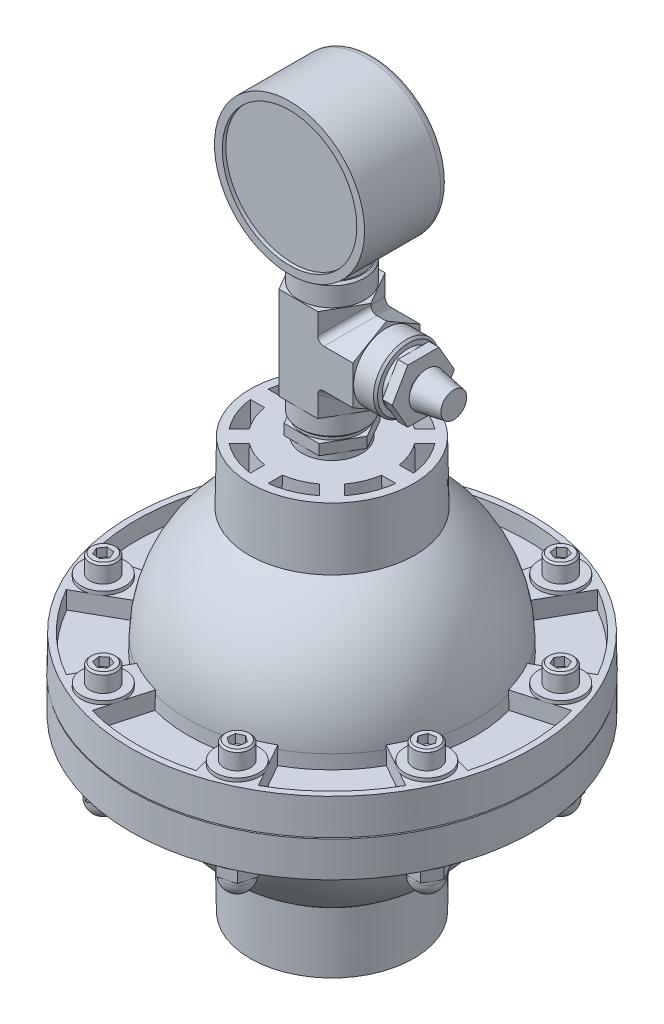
SolidWorks part; units mm, degrees
ref_plane "Front Plane" through (0, 0, 0) normal (0, 0, 1) x (1, 0, 0)
ref_plane "Top Plane" through (0, 0, 0) normal (0, 1, 0) x (1, 0, 0)
ref_plane "Right Plane" through (0, 0, 0) normal (1, 0, 0) x (0, 0, -1)
sketch "Sketch1" plane through (0, 0, 0) normal (0, 1, 0) x (1, 0, 0)
  circle A0 centre (0, 0) radius 72.39
  circle A1 centre (0, 0) radius 69.723
  dimension "D1" = 144.78
  dimension "D2" = 2.667
extrude "Boss-Extrude1" add sketch "Sketch1" along normal blind 12.7 draft 1
ref_plane "Plane1" through (0, -0.508, 0) normal (0, 1, 0) x (1, 0, 0)
sketch "Sketch5" plane through (0, 0, 0) normal (0, 1, 0) x (1, 0, 0)
  circle A0 centre (0, 0) radius 72.2624
extrude "Boss-Extrude5" add sketch "Sketch5" along normal blind 6.35
sketch "Sketch6" plane through (0, -0.508, 0) normal (0, 1, 0) x (1, 0, 0)
  circle A0 centre (0, 0) radius 59.4995
  dimension "D1" = 118.999
extrude "Boss-Extrude6" add sketch "Sketch6" along normal blind 6.35
sketch "Sketch7" plane through (0, -0.508, 0) normal (0, 1, 0) x (1, 0, 0)
  circle A0 centre (0, 0) radius 72.263
  circle A1 centre (0, 0) radius 69.596
  dimension "D1" = 2.667
extrude "Boss-Extrude7" add sketch "Sketch7" against normal blind 12.7 separate body
sketch "Sketch8" plane through (0, -0.508, 0) normal (0, 1, 0) x (1, 0, 0)
  circle A0 centre (0, 0) radius 72.263
extrude "Boss-Extrude8" add sketch "Sketch8" against normal blind 6.35 draft 1
sketch "Sketch9" plane through (0, 0, 0) normal (0, 1, 0) x (1, 0, 0)
  circle A0 centre (0, 0) radius 51.689
  dimension "D1" = 103.378
extrude "Boss-Extrude9" add sketch "Sketch9" along normal blind 59.944 draft 1
sketch "Sketch10" plane through (0, -0.508, 0) normal (0, 1, 0) x (1, 0, 0)
  circle A0 centre (0, 0) radius 51.689
extrude "Boss-Extrude10" add sketch "Sketch10" against normal blind 59.944 draft 1
ref_plane "Plane2" through (0, 73.533, 0) normal (0, 1, 0) x (1, 0, 0)
ref_plane "Plane3" through (0, -74.041, 0) normal (0, 1, 0) x (1, 0, 0)
fillet "Fillet1" radius 49.53 2 edges at (0, 59.944, 50.6427) (0, -60.452, 50.6427)
sketch "Sketch12" plane through (0, 73.533, 0) normal (0, 1, 0) x (1, 0, 0)
  circle A0 centre (0, 0) radius 29.337
  dimension "D1" = 58.674
extrude "Boss-Extrude11" add sketch "Sketch12" against normal up to surface (86.741 mm away) draft 1
sketch "Sketch13" plane through (0, -74.041, 0) normal (0, 1, 0) x (1, 0, 0)
  circle A0 centre (0, 0) radius 29.337
  dimension "D1" = 58.674
extrude "Boss-Extrude12" add sketch "Sketch13" along normal up to surface (86.741 mm away) draft 1
sketch "Sketch15" plane through (0, 73.533, 0) normal (0, 1, 0) x (1, 0, 0)
  circle A0 centre (0, 0) radius 26.289
  circle A1 centre (0, 0) radius 21.209
  dimension "D1" = 52.578
  dimension "D2" = 5.08
extrude "Cut-Extrude1" cut sketch "Sketch15" against normal blind 16.129 draft 1
sketch "Sketch16" plane through (0, -74.041, 0) normal (0, 1, 0) x (1, 0, 0)
  circle A0 centre (0, 0) radius 26.289
  circle A1 centre (0, 0) radius 21.209
  dimension "D1" = 52.578
  dimension "D2" = 5.08
extrude "Cut-Extrude2" cut sketch "Sketch16" along normal blind 16.129 draft 1
hole_wizard "1 NPT Tapped Hole2" positions "Sketch20" profile "Sketch19" size "1" standard "ANSI Inch"
sketch "Sketch20" plane through (0, -74.041, 0) normal (0, 1, 0) x (1, 0, 0)
  point P0 (0, 0)
sketch "Sketch19" plane through (0, -74.041, 0) normal (1, 0, 0) x (0, 0, -1)
  line L0 (0, 0) -> (0, 36.6469)
  line L1 (14.4907, 27.94) -> (0, 36.6469)
  line L2 (-14.4907, 27.94) -> (0, 36.6469) construction
  line L3 (14.4907, 27.94) -> (14.4907, 16.764)
  line L4 (14.4907, 16.764) -> (15.228, 16.764)
  line L5 (15.228, 16.764) -> (15.7299, 0)
  line L6 (-15.228, 16.764) -> (-15.7299, 0) construction
  line L7 (15.7299, 0) -> (0, 0)
  line L8 (0, -6.35) -> (0, 107.95) construction
  line L11 (-14.4907, 16.764) -> (-15.228, 16.764) construction
  dimension "Tap Drill Dia." = 28.9814
  dimension "Tap Drill Depth" = 27.94
  dimension "Thread Dia." = 31.4598
  dimension "Thread Angle" = 3.43
  dimension "Thread Depth" = 16.764
  dimension "Drill Angle" = 118
sketch "Sketch21" plane through (0, 73.533, 0) normal (0, 1, 0) x (1, 0, 0)
  line L0 (0, 0) -> (-33.734, 0) construction
  line L1 (-18.7204, 3.175) -> (-27.9661, 3.175)
  line L2 (-27.9661, 3.175) -> (-27.9661, -3.175)
  line L3 (-27.9661, -3.175) -> (-18.7204, -3.175)
  line L4 (-18.7204, -3.175) -> (-18.7204, 3.175)
  dimension "D1" = 3.175
  dimension "D2" = 6.35
extrude "Boss-Extrude13" add sketch "Sketch21" against normal up to surface (16.129 mm away)
pattern_circular "CirPattern1" count 8 over 360 about axis through (0, 0, 0) along (0, 1, 0) of "Boss-Extrude13"
sketch "Sketch22" plane through (0, -74.041, 0) normal (0, 1, 0) x (1, 0, 0)
  line L0 (0, 0) -> (-35.816, 0) construction
  line L1 (-18.9475, -3.175) -> (-28.1821, -3.175)
  line L2 (-28.1821, -3.175) -> (-28.1821, 3.175)
  line L3 (-28.1821, 3.175) -> (-18.9475, 3.175)
  line L4 (-18.9475, 3.175) -> (-18.9475, -3.175)
  dimension "D1" = 3.175
  dimension "D2" = 6.35
extrude "Boss-Extrude14" add sketch "Sketch22" along normal up to surface (16.129 mm away)
pattern_circular "CirPattern2" count 8 over 360 about axis through (0, 0, 0) along (0, 1, 0) of "Boss-Extrude14"
ref_plane "Plane4" through (0, 12.7, 0) normal (0, 1, 0) x (1, 0, 0)
ref_plane "Plane5" through (0, -13.208, 0) normal (0, 1, 0) x (1, 0, 0)
sketch "Sketch23" plane through (0, 12.7, 0) normal (0, 1, 0) x (1, 0, 0)
  line L0 (-44.703, 12.3972) -> (-69.031, 19.144)
  line L1 (0, 0) -> (-76.445, 0) construction
  line L2 (0, 0) -> (-68.8957, 38.9793) construction
  line L3 (0, 0) -> (-75.2794, 20.8768) construction
  line L4 (-69.031, 19.144) -> (-62.3496, 35.2757)
  line L5 (-62.3496, 35.2757) -> (-41.612, 23.543)
  line L6 (-41.612, 23.543) -> (-44.703, 12.3972)
  dimension "D1" = 29.5
  dimension "D2" = 15.5
extrude "Boss-Extrude15" add sketch "Sketch23" against normal up to surface (6.35 mm away)
pattern_circular "CirPattern3" count 8 over 360 about axis through (0, 0, 0) along (0, 1, 0) of "Boss-Extrude15"
sketch "Sketch24" plane through (0, -13.208, 0) normal (0, 1, 0) x (1, 0, 0)
  line L0 (0, 0) -> (-77.758, 0) construction
  line L1 (0, 0) -> (-75.1927, -20.8528) construction
  line L2 (0, 0) -> (-67.4621, -38.1682) construction
  line L3 (-45.2436, -12.5472) -> (-69.0113, -19.1385)
  line L4 (-69.0113, -19.1385) -> (-62.0998, -35.1344)
  line L5 (-62.0998, -35.1344) -> (-42.1153, -23.8277)
  line L6 (-42.1153, -23.8277) -> (-45.2436, -12.5472)
  dimension "D1" = 15.5
  dimension "D2" = 29.5
extrude "Boss-Extrude16" add sketch "Sketch24" along normal up to surface (6.35 mm away)
pattern_circular "CirPattern4" count 8 over 360 about axis through (0, 0, 0) along (0, 1, 0) of "Boss-Extrude16"
sketch "Sketch25" plane through (0, 12.7, 0) normal (0, 1, 0) x (1, 0, 0)
  line L0 (0, 0) -> (-76.7572, 0) construction
  line L1 (0, 0) -> (-73.8259, 30.5797) construction
  circle A0 centre (0, 0) radius 62.8015 construction
  circle A2 centre (-58.021, 24.0331) radius 7.874
  dimension "D1" = 125.603
  dimension "D3" = 15.748
  dimension "D2" = 22.5
extrude "Boss-Extrude17" add sketch "Sketch25" along normal blind 1.27
pattern_circular "CirPattern5" count 8 over 360 about axis through (0, 0, 0) along (0, 1, 0) of "Boss-Extrude17"
sketch "Sketch26" plane through (0, -13.208, 0) normal (0, 1, 0) x (1, 0, 0)
  line L0 (0, 0) -> (-77.404, 0) construction
  line L1 (0, 0) -> (-73.5901, -30.482) construction
  circle A0 centre (0, 0) radius 62.8015 construction
  circle A5 centre (-58.021, -24.0331) radius 7.874
  dimension "D1" = 125.603
  dimension "D3" = 15.748
  dimension "D2" = 22.5
extrude "Boss-Extrude18" add sketch "Sketch26" against normal blind 1.27
pattern_circular "CirPattern6" count 8 over 360 about axis through (0, 0, 0) along (0, 1, 0) of "Boss-Extrude18"
sketch "Sketch27" plane through (0, 12.7, 0) normal (0, 1, 0) x (1, 0, 0)
  circle A0 centre (-58.021, 24.0331) radius 4.7625
  dimension "D1" = 9.525
extrude "Boss-Extrude19" add sketch "Sketch27" along normal blind 7.62
ref_plane "Plane6" through (0, 20.32, 0) normal (0, 1, 0) x (1, 0, 0)
sketch "Sketch28" plane through (0, 20.32, 0) normal (0, 1, 0) x (1, 0, 0)
  line L1 (-60.7279, 23.5936) -> (-58.9938, 21.4691)
  line L2 (-58.9938, 21.4691) -> (-56.287, 21.9086)
  line L3 (-56.287, 21.9086) -> (-55.3142, 24.4726)
  line L4 (-55.3142, 24.4726) -> (-57.0482, 26.597)
  line L5 (-57.0482, 26.597) -> (-59.7551, 26.1575)
  line L6 (-59.7551, 26.1575) -> (-60.7279, 23.5936)
  circle A0 centre (-58.021, 24.0331) radius 2.3749 construction
extrude "Cut-Extrude3" cut sketch "Sketch28" against normal blind 3.048
chamfer "Chamfer1" distance 0.635 angle 45 1 edges at (-58.021, 20.32, -19.2706)
pattern_circular "CirPattern7" count 8 over 360 about axis through (0, 0, 0) along (0, 1, 0) of "Boss-Extrude19", "Cut-Extrude3", "Chamfer1"
sketch "Sketch29" plane through (0, -13.208, 0) normal (0, 1, 0) x (1, 0, 0)
  line L1 (-64.1802, 24.0331) -> (-61.1006, 18.6991)
  line L2 (-61.1006, 18.6991) -> (-54.9414, 18.6991)
  line L3 (-54.9414, 18.6991) -> (-51.8618, 24.0331)
  line L4 (-51.8618, 24.0331) -> (-54.9414, 29.3671)
  line L5 (-54.9414, 29.3671) -> (-61.1006, 29.3671)
  line L6 (-61.1006, 29.3671) -> (-64.1802, 24.0331)
  circle A0 centre (-58.021, 24.0331) radius 5.334 construction
extrude "Boss-Extrude20" add sketch "Sketch29" against normal blind 6.858
sketch "Sketch30" plane through (0, -13.208, 0) normal (0, 1, 0) x (1, 0, 0)
  circle A0 centre (-58.021, 24.0331) radius 5.207
  dimension "D1" = 10.414
extrude "Boss-Extrude21" add sketch "Sketch30" against normal blind 13.208
fillet "Fillet2" radius 5.08 1 edges at (-58.021, -26.416, -18.8261)
pattern_circular "CirPattern8" count 8 over 360 about axis through (0, 0, 0) along (0, 1, 0) of "Boss-Extrude20", "Boss-Extrude21", "Fillet2"
sketch "Sketch31" plane through (0, 73.533, 0) normal (0, 1, 0) x (1, 0, 0)
  circle A0 centre (0, 0) radius 10.668
  dimension "D1" = 21.336
extrude "Boss-Extrude22" add sketch "Sketch31" along normal blind 84.836
sketch "Sketch32" plane through (0, 0, 0) normal (0, 0, 1) x (1, 0, 0)
  line L0 (10.668, 158.369) -> (-10.668, 158.369) construction
  circle A0 centre (0, 158.369) radius 26.924
extrude "Boss-Extrude23" add sketch "Sketch32" along normal mid plane 30.48
ref_plane "Plane7" through (0, 76.073, 0) normal (0, 1, 0) x (1, 0, 0)
ref_plane "Plane8" through (0, 81.153, 0) normal (0, 1, 0) x (1, 0, 0)
sketch "Sketch33" plane through (0, 76.073, 0) normal (0, 1, 0) x (1, 0, 0)
  line L1 (-12.6116, 0) -> (-6.3058, -10.922)
  line L2 (-6.3058, -10.922) -> (6.3058, -10.922)
  line L3 (6.3058, -10.922) -> (12.6116, 0)
  line L4 (12.6116, 0) -> (6.3058, 10.922)
  line L5 (6.3058, 10.922) -> (-6.3058, 10.922)
  line L6 (-6.3058, 10.922) -> (-12.6116, 0)
  circle A0 centre (0, 0) radius 10.922 construction
  dimension "D1" = 21.844
extrude "Boss-Extrude24" add sketch "Sketch33" along normal blind 3.81
sketch "Sketch34" plane through (0, 81.153, 0) normal (0, 1, 0) x (1, 0, 0)
  circle A0 centre (0, 0) radius 11.811
  dimension "D1" = 23.622
extrude "Boss-Extrude25" add sketch "Sketch34" along normal blind 48.26
ref_plane "Plane9" through (0, 88.519, 0) normal (0, 1, 0) x (1, 0, 0)
sketch "Sketch35" plane through (0, 88.519, 0) normal (0, 1, 0) x (1, 0, 0)
  line L1 (-13.9315, 0) -> (-6.9657, -12.065)
  line L2 (-6.9657, -12.065) -> (6.9657, -12.065)
  line L3 (6.9657, -12.065) -> (13.9315, 0)
  line L4 (13.9315, 0) -> (6.9657, 12.065)
  line L5 (6.9657, 12.065) -> (-6.9657, 12.065)
  line L6 (-6.9657, 12.065) -> (-13.9315, 0)
  circle A0 centre (0, 0) radius 12.065 construction
  dimension "D1" = 24.13
extrude "Boss-Extrude26" add sketch "Sketch35" along normal blind 33.274
ref_plane "Plane10" through (19.558, 0, 0) normal (1, 0, 0) x (0, 0, -1)
ref_plane "Plane11" through (27.432, 0, 0) normal (1, 0, 0) x (0, 0, -1)
sketch "Sketch36" plane through (27.432, 0, 0) normal (1, 0, 0) x (0, 0, -1)
  line L0 (0, 121.793) -> (0, 88.519) construction
  circle A0 centre (0, 105.156) radius 11.811
  dimension "D1" = 23.622
extrude "Boss-Extrude27" add sketch "Sketch36" against normal blind 25.4
sketch "Sketch37" plane through (19.558, 0, 0) normal (1, 0, 0) x (0, 0, -1)
  line L0 (0, 121.793) -> (0, 88.519) construction
  line L1 (0, 119.0875) -> (-12.065, 112.1217)
  line L2 (-12.065, 112.1217) -> (-12.065, 98.1903)
  line L3 (-12.065, 98.1903) -> (0, 91.2245)
  line L4 (0, 91.2245) -> (12.065, 98.1903)
  line L5 (12.065, 98.1903) -> (12.065, 112.1217)
  line L6 (12.065, 112.1217) -> (0, 119.0875)
  circle A0 centre (0, 105.156) radius 12.065 construction
  dimension "D1" = 24.13
extrude "Boss-Extrude28" add sketch "Sketch37" against normal blind 25.4
ref_plane "Plane12" through (32.766, 0, 0) normal (1, 0, 0) x (0, 0, -1)
sketch "Sketch38" plane through (32.766, 0, 0) normal (1, 0, 0) x (0, 0, -1)
  line L0 (0, 121.793) -> (0, 88.519) construction
  circle A0 centre (0, 105.156) radius 9.398
  dimension "D1" = 18.796
extrude "Boss-Extrude29" add sketch "Sketch38" against normal up to surface (5.334 mm away)
sketch "Sketch39" plane through (32.766, 0, 0) normal (1, 0, 0) x (0, 0, -1)
  line L0 (0, 121.793) -> (0, 88.519) construction
  line L1 (-11.1452, 105.156) -> (-5.5726, 95.504)
  line L2 (-5.5726, 95.504) -> (5.5726, 95.504)
  line L3 (5.5726, 95.504) -> (11.1452, 105.156)
  line L4 (11.1452, 105.156) -> (5.5726, 114.808)
  line L5 (5.5726, 114.808) -> (-5.5726, 114.808)
  line L6 (-5.5726, 114.808) -> (-11.1452, 105.156)
  circle A0 centre (0, 105.156) radius 9.652 construction
  dimension "D1" = 19.304
extrude "Boss-Extrude30" add sketch "Sketch39" against normal blind 3.556
ref_plane "Plane13" through (34.036, 0, 0) normal (1, 0, 0) x (0, 0, -1)
sketch "Sketch40" plane through (34.036, 0, 0) normal (1, 0, 0) x (0, 0, -1)
  line L0 (0, 121.793) -> (0, 88.519) construction
  circle A0 centre (0, 105.156) radius 4.7625
  dimension "D1" = 9.525
extrude "Boss-Extrude31" add sketch "Sketch40" against normal up to surface (1.27 mm away)
sketch "Sketch41" plane through (34.036, 0, 0) normal (1, 0, 0) x (0, 0, -1)
  line L0 (0, 121.793) -> (0, 88.519) construction
  circle A0 centre (0, 105.156) radius 6.35
  dimension "D1" = 12.7
extrude "Boss-Extrude32" add sketch "Sketch41" along normal blind 9.652 draft 10
fillet "Fillet3" radius 3.175 1 edges at (26.924, 158.369, -15.24)
chamfer "Chamfer2" distance 0.762 angle 45 3 edges at (0, 81.153, 11.811) (27.432, 105.156, -11.811) (0, 129.413, 11.811)
fillet "Fillet4" radius 2.54 4 edges at (10.4486, 94.7074, -6.0325) (10.4486, 94.7074, 6.0325) (10.4486, 115.6046, -6.0325) (10.4486, 115.6046, 6.0325)
ref_plane "Plane14" through (0, 0, 15.24) normal (0, 0, 1) x (1, 0, 0)
sketch "Sketch42" plane through (0, 0, 15.24) normal (0, 0, 1) x (1, 0, 0)
  circle A0 centre (0, 158.369) radius 24.13
  dimension "D1" = 48.26
extrude "Cut-Extrude4" cut sketch "Sketch42" against normal blind 1.27
